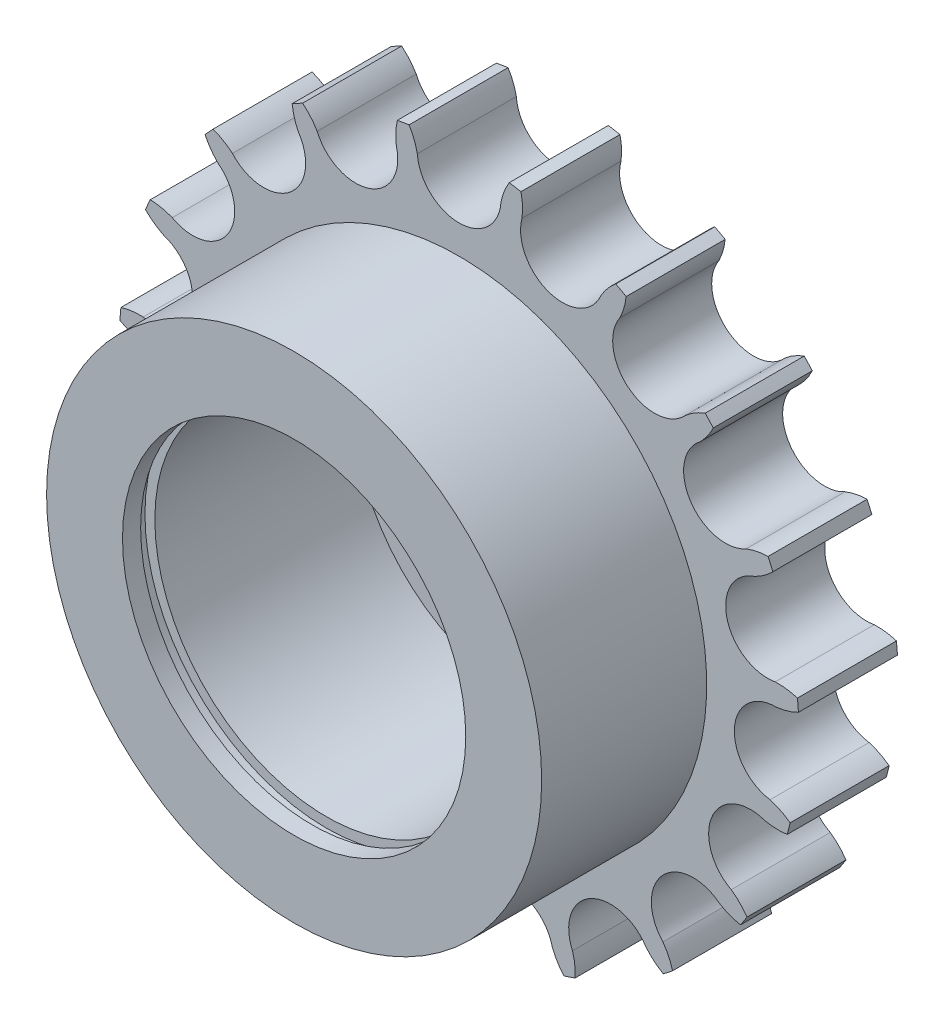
SolidWorks part; units mm, degrees
ref_plane "Face" through (0, 0, 0) normal (0, 0, 1) x (1, 0, 0)
ref_plane "Dessus" through (0, 0, 0) normal (0, 1, 0) x (1, 0, 0)
ref_plane "Droite" through (0, 0, 0) normal (1, 0, 0) x (0, 0, -1)
sketch "Esquisse1" plane through (0, 0, 0) normal (0, 0, 1) x (1, 0, 0)
  arc A0 (9.5213, 47.2484) -> (21.5069, 43.1338) centre (15.6505, 45.5884) ccw
  circle A1 centre (0, 0) radius 17.5
  arc A2 (-6.3361, 47.78) -> (6.3361, 47.78) centre (0, 48.2) ccw
  arc A3 (25.3, 44.8571) -> (23.715, 45.7148) centre (0, 0) ccw
  arc A4 (6.3361, 47.78) -> (7.5865, 50.9381) centre (15.718, 45.892) cw
  arc A5 (-6.3361, 47.78) -> (-7.5865, 50.9381) centre (-15.718, 45.892) ccw
  arc A6 (9.5213, 47.2484) -> (9.3641, 50.6415) centre (0.0347, 48.5091) ccw
  arc A7 (21.5069, 43.1338) -> (23.715, 45.7148) centre (29.7675, 38.3018) cw
  arc A8 (24.347, 41.5968) -> (34.3471, 33.8134) centre (29.6051, 38.0366) ccw
  arc A9 (24.347, 41.5968) -> (25.3, 44.8571) centre (15.7837, 45.8694) ccw
  arc A10 (34.3471, 33.8134) -> (37.2737, 35.5376) centre (40.5912, 26.561) cw
  arc A11 (36.5343, 31.4375) -> (43.4653, 20.8288) centre (40.3514, 26.3629) ccw
  arc A12 (36.5343, 31.4375) -> (38.4943, 34.2117) centre (29.8223, 38.2591) ccw
  arc A13 (43.4653, 20.8288) -> (46.7931, 21.5094) centre (47.0162, 11.942) cw
  arc A14 (44.7625, 17.8715) -> (47.8733, 5.5871) centre (46.7251, 11.8324) ccw
  arc A15 (44.7625, 17.8715) -> (47.5171, 19.8589) centre (40.6292, 26.5029) ccw
  arc A16 (47.8733, 5.5871) -> (51.2418, 5.1502) centre (48.3463, -3.9712) cw
  arc A17 (48.14, 2.3688) -> (47.0936, -10.2601) centre (48.0354, -3.9803) ccw
  arc A18 (48.14, 2.3688) -> (51.3907, 3.3542) centre (47.0332, 11.8746) ccw
  arc A19 (47.0936, -10.2601) -> (50.1377, -11.767) centre (44.4373, -19.4541) cw
  arc A20 (46.3008, -13.3906) -> (41.2104, -24.9954) centre (44.1403, -19.3617) ccw
  arc A21 (46.3008, -13.3906) -> (49.6953, -13.5141) centre (48.3405, -4.0405) ccw
  arc A22 (41.2104, -24.9954) -> (43.6003, -27.4091) centre (35.7128, -32.8287) cw
  arc A23 (39.4442, -27.6989) -> (30.8616, -37.0221) centre (35.4619, -32.645) ccw
  arc A24 (39.4442, -27.6989) -> (42.6146, -28.9179) centre (44.4094, -19.5177) ccw
  arc A25 (30.8616, -37.0221) -> (32.3382, -40.081) centre (23.1183, -42.6459) cw
  arc A26 (28.3132, -39.0056) -> (17.1683, -45.0369) centre (22.9407, -42.3906) ccw
  arc A27 (28.3132, -39.0056) -> (30.916, -41.188) centre (35.6658, -32.8799) ccw
  arc A28 (17.1683, -45.0369) -> (17.5717, -48.4095) centre (8.0186, -47.8418) cw
  arc A29 (14.114, -46.0854) -> (1.6146, -48.1712) centre (7.9335, -47.5426) ccw
  arc A30 (14.114, -46.0854) -> (15.8672, -48.9947) centre (23.0572, -42.679) ccw
  arc A31 (1.6146, -48.1712) -> (0.9011, -51.4921) centre (-7.9501, -47.8532) cw
  arc A32 (-1.6146, -48.1712) -> (-14.114, -46.0854) centre (-7.9335, -47.5426) ccw
  arc A33 (-1.6146, -48.1712) -> (-0.9011, -51.4921) centre (7.9501, -47.8532) ccw
  arc A34 (-14.114, -46.0854) -> (-15.8672, -48.9947) centre (-23.0572, -42.679) cw
  arc A35 (-17.1683, -45.0369) -> (-28.3132, -39.0056) centre (-22.9407, -42.3906) ccw
  arc A36 (-17.1683, -45.0369) -> (-17.5717, -48.4095) centre (-8.0186, -47.8418) ccw
  arc A37 (-28.3132, -39.0056) -> (-30.916, -41.188) centre (-35.6658, -32.8799) cw
  arc A38 (-30.8616, -37.0221) -> (-39.4442, -27.6989) centre (-35.4619, -32.645) ccw
  arc A39 (-30.8616, -37.0221) -> (-32.3382, -40.081) centre (-23.1183, -42.6459) ccw
  arc A40 (-39.4442, -27.6989) -> (-42.6146, -28.9179) centre (-44.4094, -19.5177) cw
  arc A41 (-41.2104, -24.9954) -> (-46.3008, -13.3906) centre (-44.1403, -19.3617) ccw
  arc A42 (-41.2104, -24.9954) -> (-43.6003, -27.4091) centre (-35.7128, -32.8287) ccw
  arc A43 (-46.3008, -13.3906) -> (-49.6953, -13.5141) centre (-48.3405, -4.0405) cw
  arc A44 (-47.0936, -10.2601) -> (-48.14, 2.3688) centre (-48.0354, -3.9803) ccw
  arc A45 (-47.0936, -10.2601) -> (-50.1377, -11.767) centre (-44.4373, -19.4541) ccw
  arc A46 (-48.14, 2.3688) -> (-51.3907, 3.3542) centre (-47.0332, 11.8746) cw
  arc A47 (-47.8733, 5.5871) -> (-44.7625, 17.8715) centre (-46.7251, 11.8324) ccw
  arc A48 (-47.8733, 5.5871) -> (-51.2418, 5.1502) centre (-48.3463, -3.9712) ccw
  arc A49 (-44.7625, 17.8715) -> (-47.5171, 19.8589) centre (-40.6292, 26.5029) cw
  arc A50 (-43.4653, 20.8288) -> (-36.5343, 31.4375) centre (-40.3514, 26.3629) ccw
  arc A51 (-43.4653, 20.8288) -> (-46.7931, 21.5094) centre (-47.0162, 11.942) ccw
  arc A52 (-36.5343, 31.4375) -> (-38.4943, 34.2117) centre (-29.8223, 38.2591) cw
  arc A53 (-34.3471, 33.8134) -> (-24.347, 41.5968) centre (-29.6051, 38.0366) ccw
  arc A54 (-34.3471, 33.8134) -> (-37.2737, 35.5376) centre (-40.5912, 26.561) ccw
  arc A55 (-24.347, 41.5968) -> (-25.3, 44.8571) centre (-15.7837, 45.8694) cw
  arc A56 (-21.5069, 43.1338) -> (-9.5213, 47.2484) centre (-15.6505, 45.5884) ccw
  arc A57 (-21.5069, 43.1338) -> (-23.715, 45.7148) centre (-29.7675, 38.3018) ccw
  arc A58 (-9.5213, 47.2484) -> (-9.3641, 50.6415) centre (-0.0347, 48.5091) cw
  arc A59 (9.3641, 50.6415) -> (7.5865, 50.9381) centre (0, 0) ccw
  arc A60 (-7.5865, 50.9381) -> (-9.3641, 50.6415) centre (0, 0) ccw
  arc A61 (-23.715, 45.7148) -> (-25.3, 44.8571) centre (0, 0) ccw
  arc A62 (-37.2737, 35.5376) -> (-38.4943, 34.2117) centre (0, 0) ccw
  arc A63 (-46.7931, 21.5094) -> (-47.5171, 19.8589) centre (0, 0) ccw
  arc A64 (38.4943, 34.2117) -> (37.2737, 35.5376) centre (0, 0) ccw
  arc A65 (47.5171, 19.8589) -> (46.7931, 21.5094) centre (0, 0) ccw
  arc A66 (51.3907, 3.3542) -> (51.2418, 5.1502) centre (0, 0) ccw
  arc A67 (-51.2418, 5.1502) -> (-51.3907, 3.3542) centre (0, 0) ccw
  arc A68 (-43.6003, -27.4091) -> (-42.6146, -28.9179) centre (0, 0) ccw
  arc A69 (-50.1377, -11.767) -> (-49.6953, -13.5141) centre (0, 0) ccw
  arc A70 (-32.3382, -40.081) -> (-30.916, -41.188) centre (0, 0) ccw
  arc A71 (49.6953, -13.5141) -> (50.1377, -11.767) centre (0, 0) ccw
  arc A72 (42.6146, -28.9179) -> (43.6003, -27.4091) centre (0, 0) ccw
  arc A73 (30.916, -41.188) -> (32.3382, -40.081) centre (0, 0) ccw
  arc A74 (15.8672, -48.9947) -> (17.5717, -48.4095) centre (0, 0) ccw
  arc A75 (-0.9011, -51.4921) -> (0.9011, -51.4921) centre (0, 0) ccw
  arc A76 (-17.5717, -48.4095) -> (-15.8672, -48.9947) centre (0, 0) ccw
  dimension "D1" = 35
  dimension "D2" = 103
  dimension "D3" = 48.2
  dimension "D4" = 12.7
  dimension "D5" = 9.57
extrude "Base-Extrusion" add sketch "Esquisse1" along normal blind 15
sketch "Esquisse3" plane through (0, 0, 15) normal (0, 0, 1) x (1, 0, 0)
  circle A0 centre (0, 0) radius 37.5
  dimension "D1" = 75
extrude "Boss.-Extru.1" add sketch "Esquisse3" along normal blind 25
sketch "Esquisse4" plane through (0, 0, 40) normal (0, 0, 1) x (1, 0, 0)
  circle A0 centre (0, 0) radius 26
  dimension "D1" = 52
extrude "Enlèv. mat.-Extru.1" cut sketch "Esquisse4" against normal blind 35
ref_plane "Plan1" through (0, 0, 37.25) normal (0, 0, 1) x (1, 0, 0)
sketch "Esquisse5" plane through (0, 0, 37.25) normal (0, 0, 1) x (1, 0, 0)
  circle A0 centre (0, 0) radius 27.5
  dimension "D1" = 55
extrude "Enlèv. mat.-Extru.2" cut sketch "Esquisse5" against normal blind 2.15
